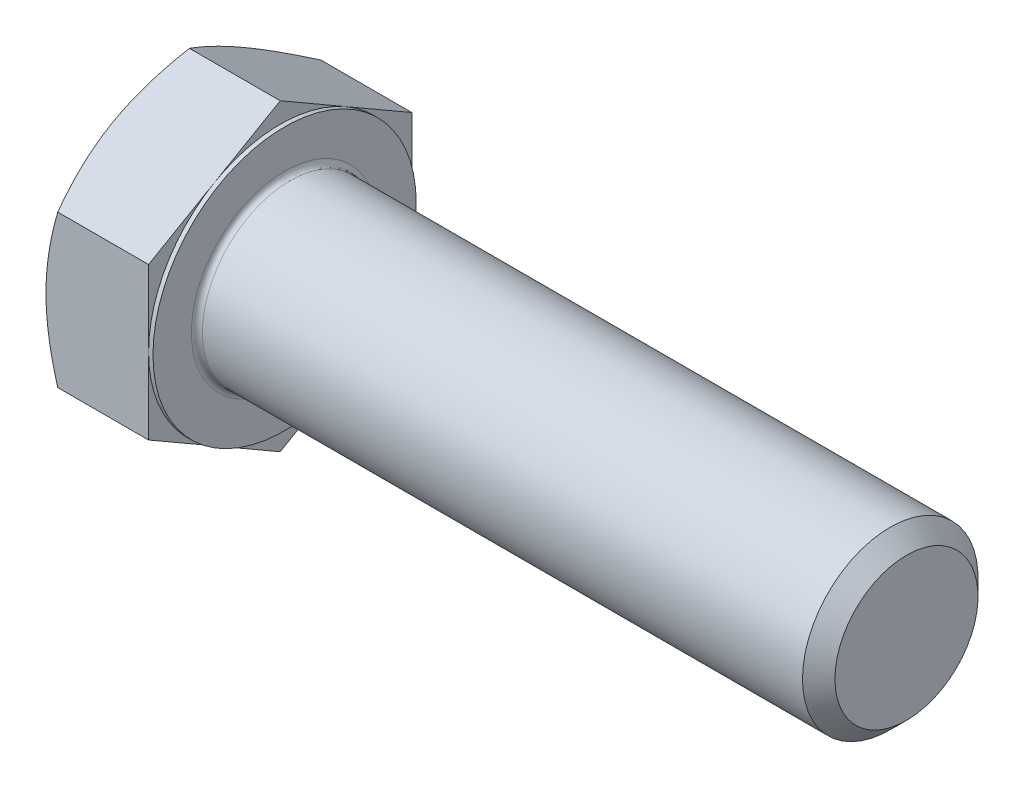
SolidWorks part; units mm, degrees
ref_plane "Front Plane" through (0, 0, 0) normal (0, 0, 1) x (1, 0, 0)
ref_plane "Top Plane" through (0, 0, 0) normal (0, 1, 0) x (1, 0, 0)
ref_plane "Right Plane" through (0, 0, 0) normal (1, 0, 0) x (0, 0, -1)
sketch "BaseHeadSke" plane through (0, 0, 0) normal (1, 0, 0) x (0, 0, -1)
  line L1 (19.05, 10.9985) -> (0, 21.997)
  line L2 (0, 21.997) -> (-19.05, 10.9985)
  line L3 (-19.05, 10.9985) -> (-19.05, -10.9985)
  line L4 (-19.05, -10.9985) -> (0, -21.997)
  line L5 (0, -21.997) -> (19.05, -10.9985)
  line L6 (19.05, -10.9985) -> (19.05, 10.9985)
  circle A0 centre (0, 0) radius 19.05 construction
  dimension "Width_flats" = 38.1
extrude "BaseHead" add sketch "BaseHeadSke" along normal blind 15.4781
sketch "BodySke" plane through (0, 0, 0) normal (0, 0, 1) x (1, 0, 0)
  line L0 (0, 0) -> (105.4781, 0)
  line L1 (105.4781, 0) -> (105.4781, 10.352)
  line L2 (105.4781, 10.352) -> (103.1301, 12.7)
  line L3 (103.1301, 12.7) -> (0, 12.7)
  line L4 (0, 12.7) -> (0, 0)
  line L5 (15.4781, 10.9985) -> (15.4781, -10.9985) construction
  line L6 (0, 0) -> (159.3976, 0) construction
  line L7 (51.4781, -84.3176) -> (51.4781, 77.7215) construction
  line L8 (102.4781, -21.5941) -> (102.4781, 39.2994) construction
  dimension "Ang" = 45
  dimension "Length" = 90
  dimension "Diameter" = 25.4
  dimension "Minor_dia" = 20.704
  dimension "Thread_length" = 54
  dimension "Advance" = 3
revolve "BaseBody" add sketch "BodySke" angle 360 about L6
sketch "HeadChamferSke" plane through (0, 0, 0) normal (0, 0, 1) x (1, 0, 0)
  line L0 (1.7015, 21.997) -> (0, 21.997)
  line L1 (0, 21.997) -> (0, 19.05)
  line L2 (0, 19.05) -> (1.7015, 21.997)
  line L3 (0, 0) -> (120.9185, 0) construction
  dimension "D1" = 30
  dimension "Head_chamfer" = 38.1
revolve "HeadChamfer" cut sketch "HeadChamferSke" angle 360 about L3
sketch "BearingFaceSke" plane through (0, 0, 0) normal (0, 0, 1) x (1, 0, 0)
  line L0 (0, 0) -> (129.6443, 0) construction
  line L1 (14.8431, 21.997) -> (15.4781, 21.997)
  line L2 (14.8431, 21.997) -> (14.8431, 19.05)
  line L3 (14.8431, 19.05) -> (15.4781, 19.05)
  line L4 (15.4781, 21.997) -> (15.4781, 19.05)
  dimension "Bearing_height" = 0.635
  dimension "Dw" = 38.1
revolve "BearingFace" cut sketch "BearingFaceSke" angle 360 about L0
fillet "Fillet" radius 0.8 1 edges at (15.4781, 0, -12.7)
sketch "ThdSchSke" plane through (0, 0, 0) normal (0, 0, 1) x (1, 0, 0)
  line L0 (101.1225, 15.4112) -> (101.1225, 12.7)
  line L1 (101.1225, 12.7) -> (102.4781, 10.352)
  line L2 (102.4781, 10.352) -> (103.8337, 12.7)
  line L3 (103.8337, 12.7) -> (103.8337, 15.4112)
  line L4 (103.8337, 15.4112) -> (101.1225, 15.4112)
  line L6 (0, 0) -> (141.9934, 0) construction
  line L7 (105.4781, -10.352) -> (105.4781, 10.352) construction
  dimension "D2" = 20.704
  dimension "D3" = 25.4
  dimension "Advance" = 3
revolve "ThreadSchematic" [suppressed] cut sketch "ThdSchSke" angle 360 about L6
pattern_linear "ThdSchPat" [suppressed] count 17 spacing 3 along (1, 0, 0)
equation "\"Thread_minor@ThreadCosmetic\" = \"Minor_dia@BodySke\""
equation "\"Thread_length@ThreadCosmetic\" = \"Thread_length@BodySke\""
equation "\"Head_chamfer@HeadChamferSke\" = \"Width_flats@BaseHeadSke\""
equation "\"D2@ThdSchSke\" = \"Minor_dia@BodySke\""
equation "\"D3@ThdSchSke\" = \"Diameter@BodySke\""
equation "\"Advance@ThdSchSke\" = \"Advance@BodySke\""
equation "\"D3@ThdSchPat\" = \"Advance@BodySke\""
equation "\"D1@ThdSchPat\" =  int( \"Thread_length@BodySke\"/\"Advance@BodySke\" )-1"
equation "\"Dw@BearingFaceSke\"=\"Width_flats@BaseHeadSke\""
